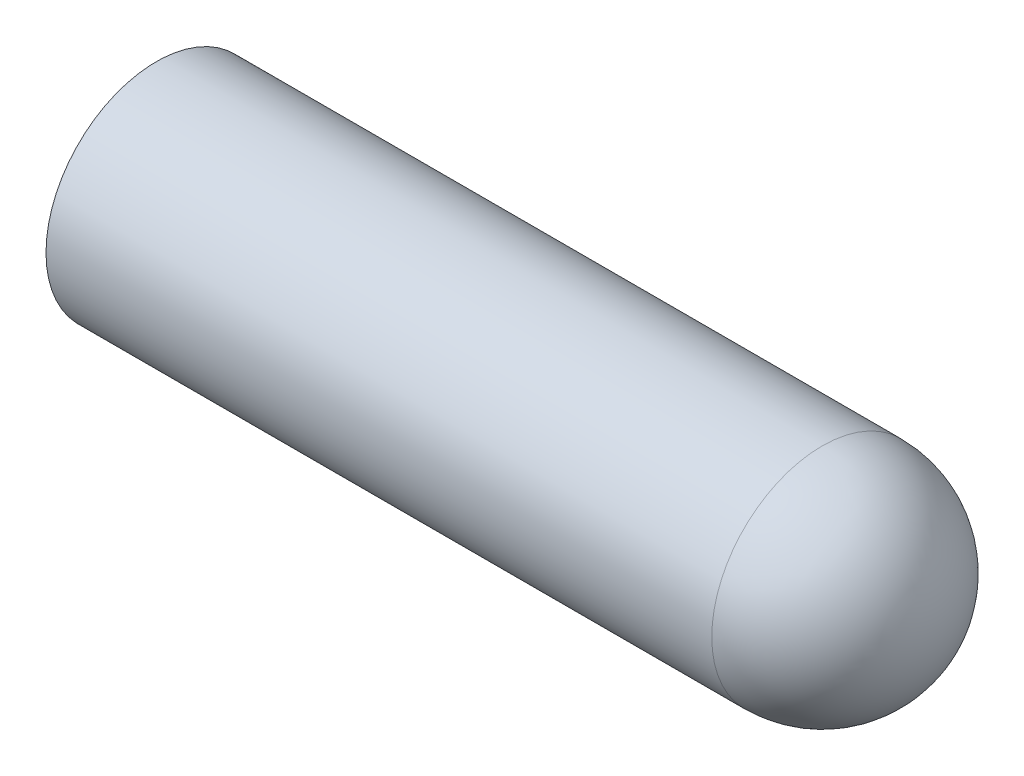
SolidWorks part; units mm, degrees
ref_plane "Front Plane" through (0, 0, 0) normal (0, 0, 1) x (1, 0, 0)
ref_plane "Top Plane" through (0, 0, 0) normal (0, 1, 0) x (1, 0, 0)
ref_plane "Right Plane" through (0, 0, 0) normal (1, 0, 0) x (0, 0, -1)
sketch "Sketch1" plane through (0, 0, 0) normal (0, 0, 1) x (1, 0, 0)
  line L0 (-27.25, 7.75) -> (19.5, 7.75)
  line L2 (-27.25, 0) -> (-27.25, 7.75)
  line L3 (-27.25, 0) -> (27.25, 0)
  arc A0 (19.5, 7.75) -> (27.25, 0) centre (19.5, 0) cw
  dimension "D1" = 54.5
  dimension "D2" = 27.25
  dimension "D4" = 7.75
revolve "Revolve1" add sketch "Sketch1" angle 360 about L3
shell "Shell1" thickness 0.8
